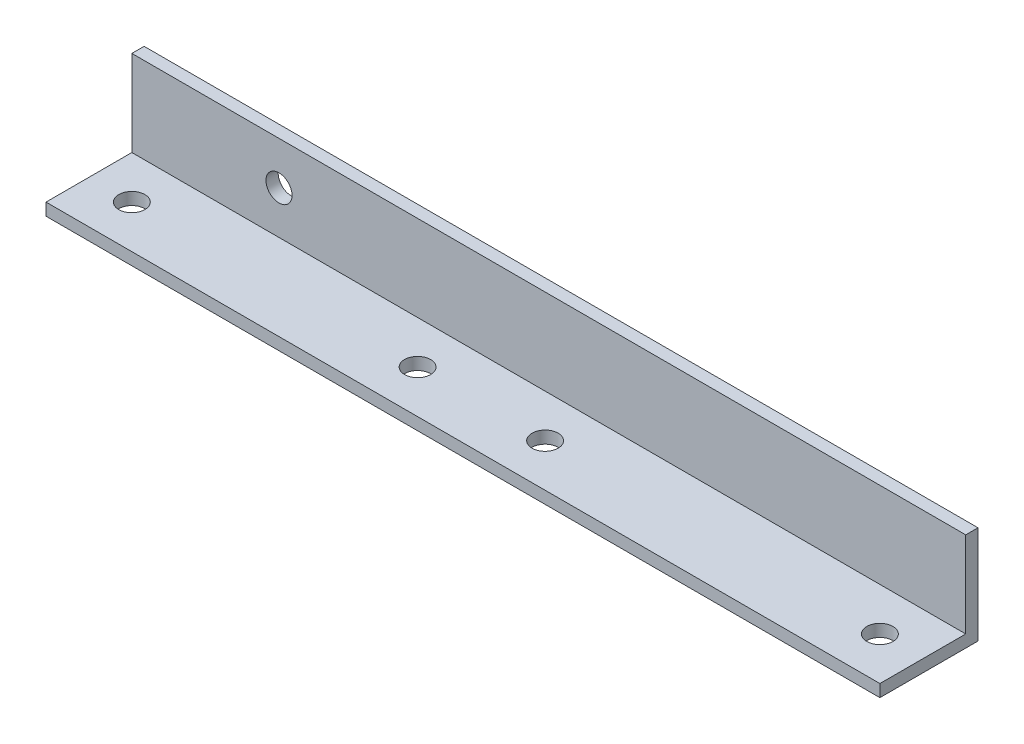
SolidWorks part; units mm, degrees
ref_plane "Front Plane" through (0, 0, 0) normal (0, 0, 1) x (1, 0, 0)
ref_plane "Top Plane" through (0, 0, 0) normal (0, 1, 0) x (1, 0, 0)
ref_plane "Right Plane" through (0, 0, 0) normal (1, 0, 0) x (0, 0, -1)
sketch "Sketch1" plane through (0, 0, 0) normal (0, 1, 0) x (1, 0, 0)
  line L1 (-107.95, 12.7) -> (107.95, 12.7)
  line L2 (-107.95, 12.7) -> (-107.95, -12.7)
  line L3 (-107.95, -12.7) -> (107.95, -12.7)
  line L4 (107.95, 12.7) -> (107.95, -12.7)
  line L5 (-107.95, 12.7) -> (107.95, -12.7) construction
  line L6 (-107.95, -12.7) -> (107.95, 12.7) construction
  point P0 (0, 0)
  dimension "D1" = 215.9
  dimension "D2" = 25.4
extrude "Boss-Extrude1" add sketch "Sketch1" along normal blind 3.175
sketch "Sketch2" plane through (0, 3.175, 0) normal (0, 1, 0) x (1, 0, 0)
  line L0 (-107.95, 12.7) -> (-107.95, 9.525)
  line L1 (-107.95, 12.7) -> (-107.95, -12.7) construction
  line L2 (-107.95, 9.525) -> (107.95, 9.525)
  line L3 (107.95, -12.7) -> (107.95, 12.7) construction
  line L4 (107.95, 9.525) -> (107.95, 12.7)
  line L5 (107.95, 12.7) -> (-107.95, 12.7)
  dimension "D1" = 3.175
extrude "Boss-Extrude2" add sketch "Sketch2" along normal blind 22.225
sketch "Sketch3" plane through (0, 3.175, 0) normal (0, 1, 0) x (1, 0, 0)
  line L0 (-107.95, -1.5875) -> (107.95, -1.5875) construction
  line L1 (-107.95, 9.525) -> (-107.95, -12.7) construction
  line L2 (107.95, -12.7) -> (107.95, 9.525) construction
  line L3 (-107.95, -12.7) -> (107.95, -12.7) construction
  circle A0 centre (-96.8375, -1.5875) radius 3.3782
  circle A1 centre (10.16, -1.5875) radius 3.3782
  circle A2 centre (96.8375, -1.5875) radius 3.3782
  circle A3 centre (-22.86, -1.5875) radius 3.3782
  dimension "D2" = 86.6775
  dimension "D3" = 6.7564
  dimension "D4" = 6.7564
  dimension "D5" = 33.02
  dimension "D7" = 6.7564
  dimension "D9" = 6.7564
  dimension "D1" = 11.1125
  dimension "D6" = 11.1125
  dimension "D8" = 11.1125
extrude "Cut-Extrude1" cut sketch "Sketch3" against normal through all
sketch "Sketch4" plane through (0, 0, -9.525) normal (0, 0, 1) x (1, 0, 0)
  line L0 (-107.95, 14.2875) -> (107.95, 14.2875) construction
  line L1 (-107.95, 25.4) -> (-107.95, 3.175) construction
  line L2 (107.95, 25.4) -> (107.95, 3.175) construction
  line L3 (-107.95, 25.4) -> (107.95, 25.4) construction
  circle A0 centre (-69.85, 14.2875) radius 3.3782
  dimension "D2" = 6.7564
  dimension "D1" = 11.1125
  dimension "D3" = 38.1
extrude "Cut-Extrude2" cut sketch "Sketch4" against normal through all
